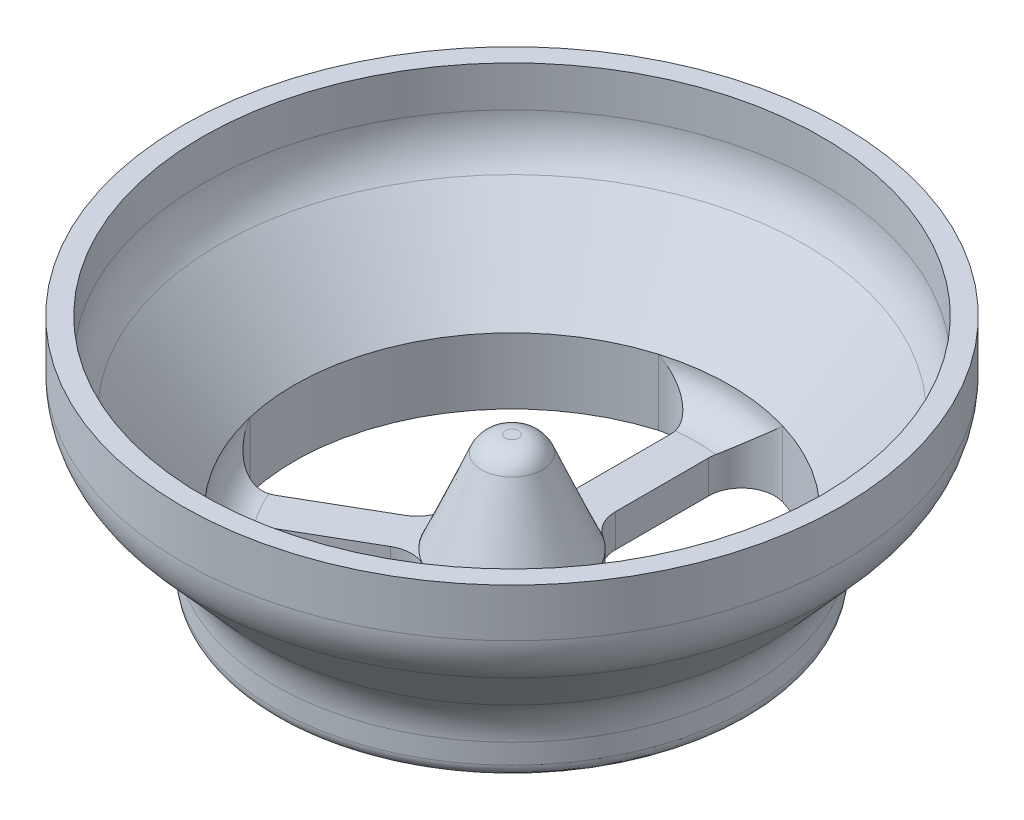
SolidWorks part; units mm, degrees
ref_plane "Front Plane" through (0, 0, 0) normal (0, 0, 1) x (1, 0, 0)
ref_plane "Top Plane" through (0, 0, 0) normal (0, 1, 0) x (1, 0, 0)
ref_plane "Right Plane" through (0, 0, 0) normal (1, 0, 0) x (0, 0, -1)
sketch "Sketch1" plane through (0, 0, 0) normal (0, 0, 1) x (1, 0, 0)
  line L0 (33, 0) -> (33, 10)
  line L1 (33, 10) -> (44.4314, 22.6959)
  line L2 (47, 29.3872) -> (47, 35.5486)
  line L3 (36, 0) -> (36, 5.0098)
  line L4 (38.5686, 11.7011) -> (47.4314, 21.5443)
  line L5 (50, 28.2356) -> (50, 35.5486)
  line L6 (47, 35.5486) -> (50, 35.5486)
  line L7 (33, 0) -> (36, 0)
  line L8 (36, 8.8484) -> (50, 24.397) construction
  line L9 (36, 0) -> (36, 8.8484) construction
  line L10 (50, 24.397) -> (50, 35.5486) construction
  line L11 (47, 25.5486) -> (47, 35.5486) construction
  line L12 (33, 10) -> (47, 25.5486) construction
  line L13 (0, 20) -> (0, 10)
  line L14 (10, -0.0688) -> (10, 4.9312)
  line L15 (33, 10) -> (69.9431, 10) construction
  line L16 (0, 10) -> (5, 10)
  line L17 (5, 10) -> (5, -0.0688)
  line L18 (5, -0.0688) -> (10, -0.0688)
  line L19 (10, 4.9312) -> (4.5867, 17.63)
  line L20 (0, 20) -> (1, 20)
  line L21 (0, 0) -> (0, 30.6695) construction
  arc A0 (38.5686, 11.7011) -> (36, 5.0098) centre (46, 5.0098) ccw
  arc A1 (50, 28.2356) -> (47.4314, 21.5443) centre (40, 28.2356) cw
  arc A2 (47, 29.3872) -> (44.4314, 22.6959) centre (37, 29.3872) cw
  arc A3 (1, 20) -> (4.5867, 17.63) centre (1, 16.101) cw
  point P18 (47, 25.5486)
  dimension "D7" = 10
  dimension "D13" = 10
  dimension "D2" = 10
  dimension "D3" = 10
  dimension "D4" = 33
  dimension "D5" = 48
  dimension "D6" = 50
  dimension "D8" = 1
  dimension "D9" = 5
  dimension "D10" = 5
  dimension "D11" = 5
  dimension "D12" = 10
  dimension "D1" = 3
revolve "Revolve1" add sketch "Sketch1" angle 360 about L13
sketch "Sketch2" plane through (0, 0, 0) normal (0, 1, 0) x (1, 0, 0)
  line L0 (0, 33) -> (0, 10) construction
  line L1 (-3, 32.8634) -> (-3, 9.5394)
  line L2 (3, 32.8634) -> (3, 9.5394)
  line L3 (-3, 33) -> (-3, 11.1072) construction
  line L4 (3, 33) -> (3, 11.1072) construction
  line L5 (29.9605, -13.8336) -> (9.7614, -2.1716)
  line L6 (26.9605, -19.0298) -> (6.7614, -7.3678)
  line L7 (-26.9605, -19.0298) -> (-6.7614, -7.3678)
  line L8 (-29.9605, -13.8336) -> (-9.7614, -2.1716)
  line L9 (0, 33) -> (0, 11.1072) construction
  circle A0 centre (0, 0) radius 33 construction
  arc A2 (26.9605, -19.0298) -> (29.9605, -13.8336) centre (0, 0) ccw
  arc A4 (3, 32.8634) -> (-3, 32.8634) centre (0, 0) ccw
  arc A5 (6.7614, -7.3678) -> (9.7614, -2.1716) centre (0, 0) ccw
  arc A6 (-29.9605, -13.8336) -> (-26.9605, -19.0298) centre (0, 0) ccw
  arc A7 (-9.7614, -2.1716) -> (-6.7614, -7.3678) centre (0, 0) ccw
  circle A9 centre (0, 0) radius 10 construction
  arc A10 (3, 9.5394) -> (-9.7614, -2.1716) centre (0, 0) ccw
  point P24 (0, 0)
  dimension "D1" = 3
  dimension "D2" = 3
  dimension "D3" = 3
extrude "Boss-Extrude1" add sketch "Sketch2" along normal blind 5 contours A10 L2 A4 L1 | A5 L6 A2 L5 | A7 L8 A6 L7
fillet "Fillet1" radius 5 6 edges at (9.7614, 2.4656, 2.1716) (3, 2.4656, -9.5394) (-3, 2.4656, -9.5394) (-9.7614, 2.4656, 2.1716) (-6.7614, 2.4656, 7.3678) (6.7614, 2.4656, 7.3678)
fillet "Fillet2" radius 5 9 edges at (26.9605, 2.5, 19.0298) (29.9605, 2.5, 13.8336) (28.5788, 5, 16.5) (3, 2.5, -32.8634) (0, 5, -33) (-3, 2.5, -32.8634) (-28.5788, 5, 16.5) (-26.9605, 2.5, 19.0298) (-29.9605, 2.5, 13.8336)
fillet "Fillet3" radius 2 1 edges at (-5, -0.0688, 0)
fillet "Fillet4" radius 2 1 edges at (-36, 0, 0)
